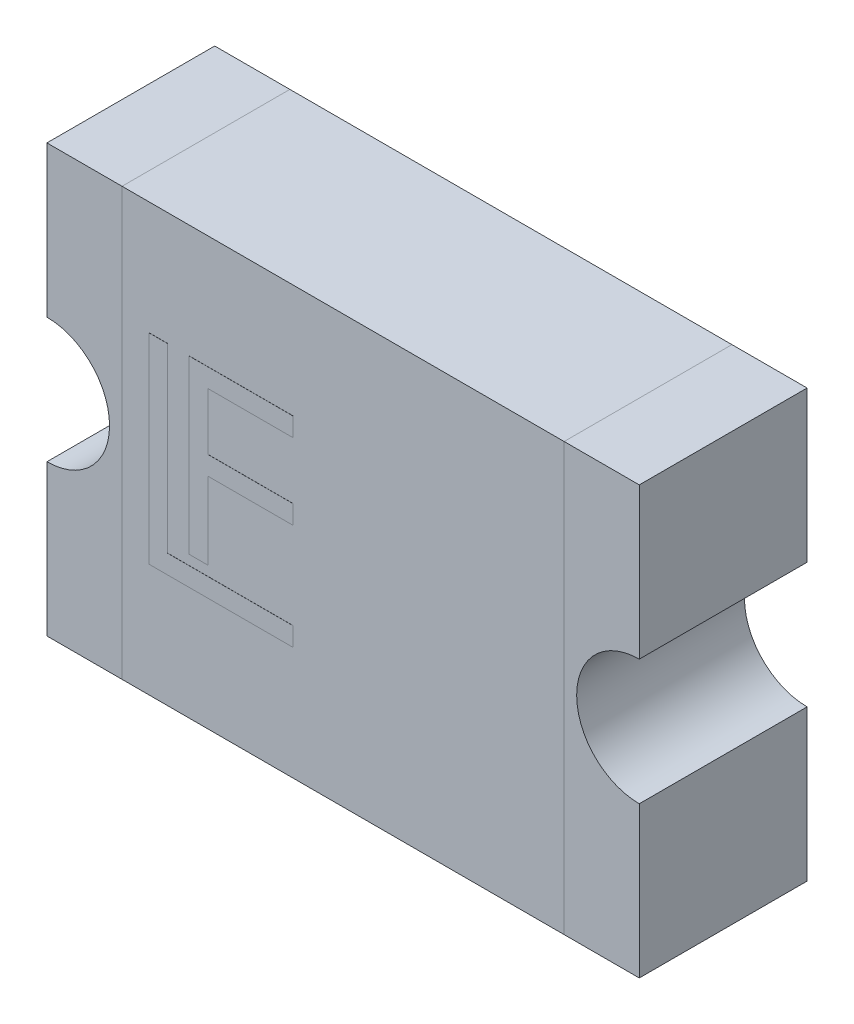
SolidWorks part; units mm, degrees
ref_plane "Front Plane" through (0, 0, 0) normal (0, 0, 1) x (1, 0, 0)
ref_plane "Top Plane" through (0, 0, 0) normal (0, 1, 0) x (1, 0, 0)
ref_plane "Right Plane" through (0, 0, 0) normal (1, 0, 0) x (0, 0, -1)
sketch "Sketch1" plane through (0, 0, 0) normal (0, 0, 1) x (1, 0, 0)
  line L1 (-1.765, 1.705) -> (1.765, 1.705)
  line L2 (-1.765, 1.705) -> (-1.765, -1.705)
  line L3 (-1.765, -1.705) -> (1.765, -1.705)
  line L4 (1.765, 1.705) -> (1.765, -1.705)
extrude "Extrude1" add sketch "Sketch1" along normal blind 1.34
sketch "Sketch2" plane through (0, 0, 0) normal (0, 0, 1) x (1, 0, 0)
  line L0 (-2.365, 1.705) -> (-2.365, 0.5)
  line L1 (-2.365, -0.5) -> (-2.365, -1.705)
  line L2 (-1.765, -1.705) -> (-2.365, -1.705)
  line L3 (-1.765, -1.705) -> (-1.765, 1.705)
  line L4 (-1.765, 1.705) -> (-2.365, 1.705)
  line L6 (1.765, 1.705) -> (2.365, 1.705)
  line L7 (1.765, -1.705) -> (1.765, 1.705)
  line L8 (1.765, -1.705) -> (2.365, -1.705)
  line L9 (2.365, -0.5) -> (2.365, -1.705)
  line L10 (2.365, 1.705) -> (2.365, 0.5)
  arc A0 (-2.365, -0.5) -> (-2.365, 0.5) centre (-2.365, 0) ccw
  arc A1 (2.365, -0.5) -> (2.365, 0.5) centre (2.365, 0) cw
extrude "Extrude2" add sketch "Sketch2" along normal blind 1.34 separate body
sketch "Sketch3" plane through (0, 0, 1.34) normal (0, 0, 1) x (1, 0, 0)
  line L4 (-1.5503, 0.8) -> (-1.5503, -0.8)
  line L5 (-1.5503, -0.8) -> (-0.4, -0.8)
  line L6 (-0.4, -0.8) -> (-0.4, -0.65)
  line L7 (-1.5503, 0.8) -> (-1.4003, 0.8)
  line L8 (-1.4003, 0.8) -> (-1.4003, -0.65)
  line L9 (-1.4003, -0.65) -> (-0.4, -0.65)
  line L10 (-1.2284, 0.8) -> (-1.2284, -0.5713)
  line L11 (-1.2284, -0.5713) -> (-1.0784, -0.5713)
  line L12 (-0.4, 0.044) -> (-1.0784, 0.044)
  line L13 (-1.0784, 0.044) -> (-1.0784, -0.5713)
  line L14 (-1.0784, 0.65) -> (-0.4, 0.65)
  line L15 (-1.0784, 0.194) -> (-0.4, 0.194)
  line L16 (-1.2284, 0.8) -> (-0.4, 0.8)
  line L17 (-1.0784, 0.194) -> (-1.0784, 0.65)
  line L18 (-0.4, 0.194) -> (-0.4, 0.044)
  line L19 (-0.4, 0.8) -> (-0.4, 0.65)
extrude "Extrude3" add sketch "Sketch3" along normal blind 0.001 separate body
